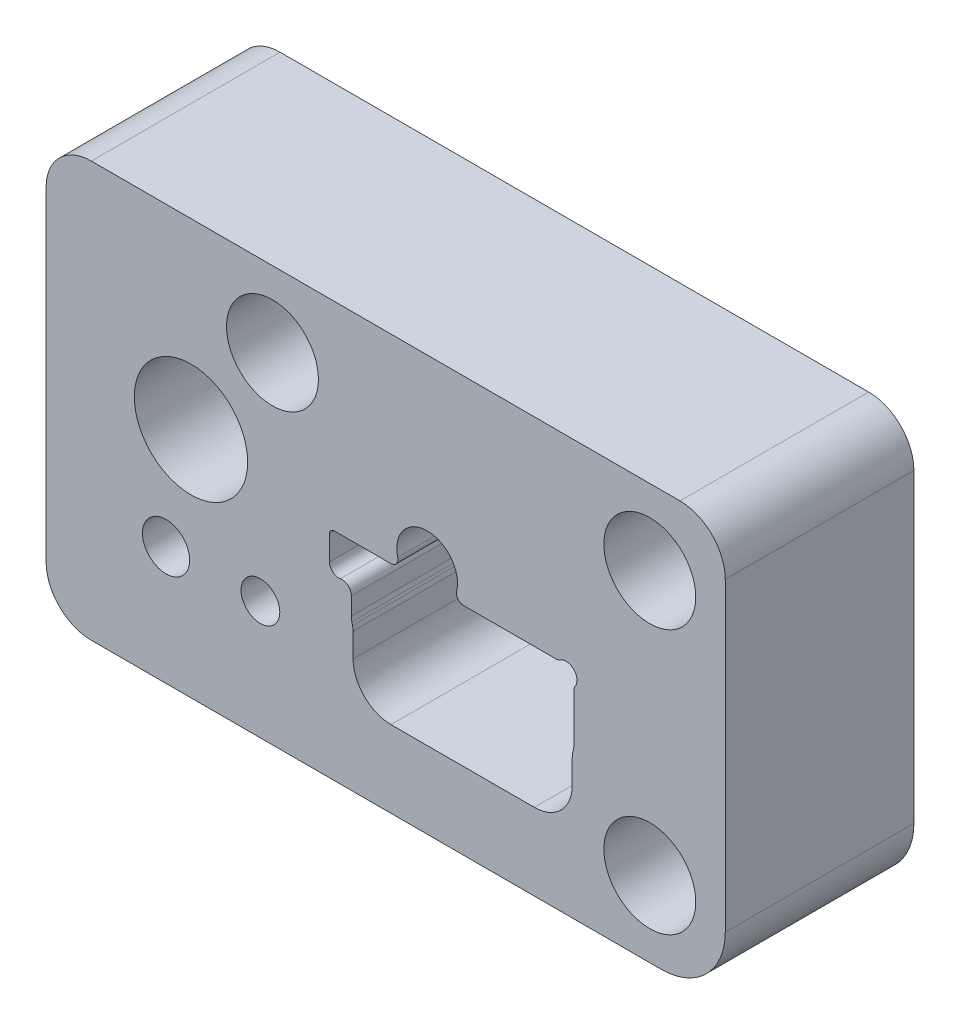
SolidWorks part; units mm, degrees
ref_plane "Front" through (0, 0, 0) normal (0, 0, 1) x (1, 0, 0)
ref_plane "Top" through (0, 0, 0) normal (0, 1, 0) x (1, 0, 0)
ref_plane "Right" through (0, 0, 0) normal (1, 0, 0) x (0, 0, -1)
ref_plane "Plane1"
sketch "Sketch1" plane through (0, 0, 0) normal (0, 0, 1) x (1, 0, 0)
  line L1 (-200.025, -47.625) -> (-100.965, -47.625)
  line L2 (-207.645, -55.245) -> (-207.645, -109.855)
  line L3 (-200.025, -117.475) -> (-104.14, -117.475)
  line L4 (-93.345, -55.245) -> (-93.345, -106.68)
  line L5 (-57.15, -180.975) -> (-450.85, -180.975) construction
  line L10 (-141.351, 0) -> (-181.102, 0) construction
  line L11 (-141.351, -85.471) -> (-141.351, 85.471) construction
  arc A2 (-100.965, -47.625) -> (-93.345, -55.245) centre (-100.965, -55.245) cw
  arc A3 (-207.645, -109.855) -> (-200.025, -117.475) centre (-200.025, -109.855) ccw
  arc A4 (-104.14, -117.475) -> (-93.345, -106.68) centre (-104.14, -106.68) ccw
  arc A5 (-200.025, -47.625) -> (-207.645, -55.245) centre (-200.025, -55.245) ccw
  point P19 (-93.345, -47.625)
  point P24 (-93.345, -117.475)
  point P27 (-207.645, -47.625)
extrude "Boss-Extrude1" add sketch "Sketch1" against normal blind 31.75 flip side to cut
hole_wizard "Hole1" positions "Point_Sketch" profile "Profil_Sketch" counterbore size "1/4" standard "ANSI Inch"
sketch "Point_Sketch" plane through (-74.4641, -53.04, 0) normal (0, 0, -1) x (1, 0, 0)
  point P0 (-31.5809, 7.285)
  point P2 (-31.5809, 51.735)
  point P4 (-95.0809, 7.285)
sketch "Profil_Sketch" plane through (-106.045, -60.325, 0) normal (1, 0, 0) x (0, -1, 0)
  line L0 (0, 0) -> (0, 31.75)
  line L1 (0, 31.75) -> (5.1562, 31.75)
  line L3 (5.1562, 31.75) -> (5.1562, 17.526)
  line L4 (5.1562, 17.526) -> (7.7343, 17.526)
  line L5 (7.7343, 17.526) -> (7.7343, 0)
  line L7 (7.7343, 0) -> (0, 0)
  line L11 (0, -6.35) -> (0, 107.95) construction
  dimension "Diameter" = 10.3124
  dimension "Thru Hole Depth" = 31.75
  dimension "L1" = 17.526
other "usin_LS160_.375-16x1.75-SHCS<1>"
ref_plane "Plane2 QU250515L_Punch[Mounted in the strip]-3"
ref_plane "Plane1 QU250515L_Punch[Mounted in the strip]-3"
sketch "Sketch2 QU250515L_Punch[Mounted in the strip]-3" plane through (0, 0, 0) normal (0, 0, 1) x (1, 0, 0)
  line L0 (-119.126, -98.171) -> (-119.126, -84.1078)
  line L1 (-149.606, -104.521) -> (-125.476, -104.521)
  line L2 (-155.956, -88.8003) -> (-155.956, -98.171)
  line L3 (-159.5202, -82.2415) -> (-157.4416, -84.7186)
  line L4 (-149.6352, -81.407) -> (-159.131, -81.407)
  line L5 (-121.8268, -81.407) -> (-137.3848, -81.407)
  line L6 (-121.8268, -81.407) -> (-137.3848, -81.407)
  line L7 (-149.6352, -81.407) -> (-159.131, -81.407)
  line L8 (-159.5202, -82.2415) -> (-157.4416, -84.7186)
  line L9 (-155.956, -88.8003) -> (-155.956, -98.171)
  line L10 (-149.606, -104.521) -> (-125.476, -104.521)
  line L11 (-119.126, -98.171) -> (-119.126, -84.1078)
  arc A0 (-118.872, -83.2654) -> (-120.9844, -81.153) centre (-120.142, -82.423) ccw
  arc A1 (-118.872, -83.2654) -> (-119.126, -84.1078) centre (-117.602, -84.1078) ccw
  arc A2 (-125.476, -104.521) -> (-119.126, -98.171) centre (-125.476, -98.171) ccw
  arc A3 (-155.956, -98.171) -> (-149.606, -104.521) centre (-149.606, -98.171) ccw
  arc A4 (-155.956, -88.8003) -> (-157.4416, -84.7186) centre (-162.306, -88.8003) ccw
  arc A5 (-159.131, -81.407) -> (-159.5202, -82.2415) centre (-159.131, -81.915) ccw
  arc A6 (-149.6352, -81.407) -> (-148.1562, -79.515) centre (-149.6352, -79.883) ccw
  arc A7 (-138.8638, -79.515) -> (-148.1562, -79.515) centre (-143.51, -78.359) ccw
  arc A8 (-138.8638, -79.515) -> (-137.3848, -81.407) centre (-137.3848, -79.883) ccw
  arc A9 (-121.8268, -81.407) -> (-120.9844, -81.153) centre (-121.8268, -79.883) ccw
  arc A10 (-121.8268, -81.407) -> (-120.9844, -81.153) centre (-121.8268, -79.883) ccw
  arc A11 (-138.8638, -79.515) -> (-137.3848, -81.407) centre (-137.3848, -79.883) ccw
  arc A12 (-138.8638, -79.515) -> (-148.1562, -79.515) centre (-143.51, -78.359) ccw
  arc A13 (-149.6352, -81.407) -> (-148.1562, -79.515) centre (-149.6352, -79.883) ccw
  arc A14 (-159.131, -81.407) -> (-159.5202, -82.2415) centre (-159.131, -81.915) ccw
  arc A15 (-155.956, -88.8003) -> (-157.4416, -84.7186) centre (-162.306, -88.8003) ccw
  arc A16 (-155.956, -98.171) -> (-149.606, -104.521) centre (-149.606, -98.171) ccw
  arc A17 (-125.476, -104.521) -> (-119.126, -98.171) centre (-125.476, -98.171) ccw
  arc A18 (-118.872, -83.2654) -> (-119.126, -84.1078) centre (-117.602, -84.1078) ccw
  arc A19 (-118.872, -83.2654) -> (-120.9844, -81.153) centre (-120.142, -82.423) ccw
  circle A20 centre (-146.431, -93.091) radius 6.5405
  circle A21 centre (-128.651, -93.091) radius 6.5405
  circle A26 centre (-143.51, -78.359) radius 1.2065
  circle A32 centre (-128.651, -93.091) radius 6.5405
  circle A33 centre (-146.431, -93.091) radius 6.5405
  circle A37 centre (-143.51, -78.359) radius 1.2065
sketch "Sketch1 QU250515L_Punch[Mounted in the strip]-3" plane through (0, 0, -4.7625) normal (0, 0, 1) x (1, 0, 0)
  line L0 (-159.5202, -82.2415) -> (-157.4416, -84.7186) construction
  line L1 (-149.6352, -81.407) -> (-159.131, -81.407) construction
  line L2 (-121.8268, -81.407) -> (-137.3848, -81.407) construction
  line L3 (-159.5202, -82.2415) -> (-157.4416, -84.7186) construction
  line L4 (-149.6352, -81.407) -> (-159.131, -81.407) construction
  line L5 (-121.8268, -81.407) -> (-137.3848, -81.407) construction
  line L18 (-119.126, -92.4223) -> (-119.126, -84.1078) construction
  line L19 (-119.126, -98.171) -> (-119.126, -84.1078) construction
  line L20 (-155.956, -88.8003) -> (-155.956, -92.4295) construction
  line L21 (-155.956, -88.8003) -> (-155.956, -98.171) construction
  line L22 (-155.9814, -92.4311) -> (-155.9814, -98.171) construction
  line L23 (-159.7653, -82.4473) -> (-157.6868, -84.9244)
  line L24 (-149.6352, -81.087) -> (-159.131, -81.087)
  line L25 (-121.8268, -81.087) -> (-137.3848, -81.087)
  line L26 (-119.1006, -98.171) -> (-119.1006, -92.5853) construction
  line L27 (-155.956, -92.4311) -> (-155.956, -98.171) construction
  line L28 (-119.126, -98.171) -> (-119.126, -92.5853) construction
  line L29 (-149.606, -104.521) -> (-125.476, -104.521) construction
  line L30 (-149.606, -104.521) -> (-125.476, -104.521) construction
  line L31 (-155.9814, -94.1476) -> (-155.9814, -98.171)
  line L32 (-149.606, -104.5464) -> (-125.476, -104.5464)
  line L33 (-119.1006, -98.171) -> (-119.1006, -94.1476)
  line L34 (-156.276, -88.8003) -> (-156.276, -92.4295) construction
  line L35 (-118.806, -92.4223) -> (-118.806, -84.1078) construction
  line L36 (-156.276, -88.8003) -> (-156.276, -92.0344)
  line L37 (-118.806, -92.0344) -> (-118.806, -84.1078)
  line L38 (-156.1808, -92.8667) -> (-156.0767, -93.3153)
  line L39 (-119.0053, -93.3153) -> (-118.9012, -92.8667)
  arc A0 (-155.956, -88.8003) -> (-157.4416, -84.7186) centre (-162.306, -88.8003) ccw construction
  arc A1 (-159.131, -81.407) -> (-159.5202, -82.2415) centre (-159.131, -81.915) ccw construction
  arc A2 (-149.6352, -81.407) -> (-148.1562, -79.515) centre (-149.6352, -79.883) ccw construction
  arc A3 (-138.8638, -79.515) -> (-148.1562, -79.515) centre (-143.51, -78.359) ccw construction
  arc A4 (-138.8638, -79.515) -> (-137.3848, -81.407) centre (-137.3848, -79.883) ccw construction
  arc A5 (-121.8268, -81.407) -> (-120.9844, -81.153) centre (-121.8268, -79.883) ccw construction
  arc A6 (-118.872, -83.2654) -> (-120.9844, -81.153) centre (-120.142, -82.423) ccw construction
  arc A7 (-118.872, -83.2654) -> (-119.126, -84.1078) centre (-117.602, -84.1078) ccw construction
  arc A8 (-155.956, -88.8003) -> (-157.4416, -84.7186) centre (-162.306, -88.8003) ccw construction
  arc A9 (-159.131, -81.407) -> (-159.5202, -82.2415) centre (-159.131, -81.915) ccw construction
  arc A11 (-149.6352, -81.407) -> (-148.1562, -79.515) centre (-149.6352, -79.883) ccw construction
  arc A12 (-138.8638, -79.515) -> (-148.1562, -79.515) centre (-143.51, -78.359) ccw construction
  arc A13 (-138.8638, -79.515) -> (-137.3848, -81.407) centre (-137.3848, -79.883) ccw construction
  arc A14 (-121.8268, -81.407) -> (-120.9844, -81.153) centre (-121.8268, -79.883) ccw construction
  arc A15 (-118.872, -83.2654) -> (-120.9844, -81.153) centre (-120.142, -82.423) ccw construction
  arc A18 (-118.872, -83.2654) -> (-119.126, -84.1078) centre (-117.602, -84.1078) ccw construction
  arc A19 (-156.276, -88.8003) -> (-157.6868, -84.9244) centre (-162.306, -88.8003) ccw
  arc A20 (-159.131, -81.087) -> (-159.7653, -82.4473) centre (-159.131, -81.915) ccw
  arc A21 (-149.6352, -81.087) -> (-148.4668, -79.5923) centre (-149.6352, -79.883) ccw
  arc A22 (-138.5532, -79.5923) -> (-148.4668, -79.5923) centre (-143.51, -78.359) ccw
  arc A23 (-138.5532, -79.5923) -> (-137.3848, -81.087) centre (-137.3848, -79.883) ccw
  arc A24 (-121.8268, -81.087) -> (-121.1613, -80.8863) centre (-121.8268, -79.883) ccw
  arc A25 (-118.6053, -83.4423) -> (-121.1613, -80.8863) centre (-120.142, -82.423) ccw
  arc A26 (-118.6053, -83.4423) -> (-118.806, -84.1078) centre (-117.602, -84.1078) ccw
  arc A27 (-125.476, -104.521) -> (-119.126, -98.171) centre (-125.476, -98.171) ccw construction
  arc A28 (-155.956, -98.171) -> (-149.606, -104.521) centre (-149.606, -98.171) ccw construction
  arc A29 (-125.476, -104.521) -> (-119.126, -98.171) centre (-125.476, -98.171) ccw construction
  arc A30 (-155.956, -98.171) -> (-149.606, -104.521) centre (-149.606, -98.171) ccw construction
  arc A31 (-155.9814, -98.171) -> (-149.606, -104.5464) centre (-149.606, -98.171) ccw
  arc A32 (-125.476, -104.5464) -> (-119.1006, -98.171) centre (-125.476, -98.171) ccw
  arc A33 (-155.9814, -94.1476) -> (-156.0767, -93.3153) centre (-159.6644, -94.1476) ccw
  arc A34 (-119.1006, -94.1476) -> (-119.0053, -93.3153) centre (-115.4176, -94.1476) cw
  arc A35 (-118.806, -92.0344) -> (-118.9012, -92.8667) centre (-122.489, -92.0344) cw
  arc A36 (-156.276, -92.0344) -> (-156.1808, -92.8667) centre (-152.593, -92.0344) ccw
  point P69 (-155.9814, -93.726)
  point P77 (-156.276, -92.456)
sketch "Sketch6" plane through (0, 0, 0) normal (0, 0, 1) x (1, 0, 0)
  circle A0 centre (-183.261, -78.359) radius 9.5377
  circle A1 centre (-302.514, -78.359) radius 9.5377 construction
extrude "Cut-Extrude2" cut sketch "Sketch6" against normal through all
hole_wizard "Hole12" positions "Point_Sketch2" profile "Profil_Sketch2" tap size "5/16-18" standard "ANSI Inch"
sketch "Point_Sketch2" plane through (-173.9939, -87.9303, 0) normal (0, 0, -1) x (-1, 0, 0)
  point P0 (-2.4169, -9.6057)
sketch "Profil_Sketch2" plane through (-171.577, -97.536, 0) normal (1, 0, 0) x (0, -1, 0)
  line L0 (0, 0) -> (0, 31.75)
  line L1 (0, 31.75) -> (3.2639, 31.75)
  line L2 (3.2639, 31.75) -> (3.2639, 0)
  line L5 (3.2639, 0) -> (0, 0)
  line L11 (0, -6.35) -> (0, 107.95) construction
  dimension "Thru Tap Drill Dia." = 6.5278
  dimension "Thru Tap Drill Depth" = 31.75
other "usin_TS230_.3125-18x.75-SHCS<1>"
hole_wizard "Hole13" positions "Point_Sketch3" profile "Profil_Sketch3" hole size "Ø0.15" standard "ISO"
sketch "Point_Sketch3" plane through (-183.7977, -86.9349, -31.75) normal (0, 0, 1) x (-1, 0, 0)
  point P0 (3.6543, 10.6011)
sketch "Profil_Sketch3" plane through (-187.452, -97.536, -31.75) normal (1, 0, 0) x (0, 1, 0)
  line L0 (0, 0) -> (0, 31.75)
  line L1 (0, 31.75) -> (3.9687, 31.75)
  line L2 (3.9687, 31.75) -> (3.9687, 0)
  line L5 (3.9687, 0) -> (0, 0)
  line L11 (0, -6.35) -> (0, 107.95) construction
  dimension "Diameter" = 7.9375
  dimension "Thru Hole Depth" = 31.75
other "usin_DL090_.3125 x 1.25 DOWEL PIN<1>"
extrude "Cut-Extrude1 QU250515L_Punch[Mounted in the strip]-3" cut sketch "Sketch1 QU250515L_Punch[Mounted in the strip]-3" against normal through all and the other way through all
sketch "Sketch7" plane through (0, 0, 0) normal (0, 0, 1) x (1, 0, 0)
  line L0 (-159.959, -81.915) -> (-159.959, -85.979)
  line L3 (-141.351, -85.471) -> (-181.102, -85.471) construction
  line L4 (-158.877, -84.1078) -> (-158.877, -85.471) construction
  line L10 (-155.9814, -94.1476) -> (-155.9814, -98.171)
  line L11 (-149.606, -104.5464) -> (-125.476, -104.5464)
  line L12 (-119.1006, -98.171) -> (-119.1006, -94.1476)
  line L13 (-119.0053, -93.3153) -> (-118.9012, -92.8667)
  line L14 (-118.806, -92.0344) -> (-118.806, -84.1078)
  line L15 (-121.8268, -81.087) -> (-137.3848, -81.087)
  line L16 (-149.6352, -81.087) -> (-159.131, -81.087)
  line L17 (-159.7653, -82.4473) -> (-157.6868, -84.9244)
  line L18 (-156.276, -88.8003) -> (-156.276, -92.0344)
  line L19 (-156.1808, -92.8667) -> (-156.0767, -93.3153)
  line L27 (-159.7653, -82.4473) -> (-157.6868, -84.9244)
  line L28 (-156.276, -88.8003) -> (-156.276, -89.1131)
  arc A0 (-159.959, -85.979) -> (-158.1175, -87.546) centre (-158.3715, -85.979) ccw
  arc A1 (-156.276, -89.1131) -> (-158.1175, -87.546) centre (-157.8635, -89.1131) ccw
  arc A14 (-155.9814, -98.171) -> (-149.606, -104.5464) centre (-149.606, -98.171) ccw
  arc A15 (-125.476, -104.5464) -> (-119.1006, -98.171) centre (-125.476, -98.171) ccw
  arc A16 (-119.0053, -93.3153) -> (-119.1006, -94.1476) centre (-115.4176, -94.1476) ccw
  arc A17 (-118.9012, -92.8667) -> (-118.806, -92.0344) centre (-122.489, -92.0344) ccw
  arc A18 (-118.6053, -83.4423) -> (-118.806, -84.1078) centre (-117.602, -84.1078) ccw
  arc A19 (-118.6053, -83.4423) -> (-121.1613, -80.8863) centre (-120.142, -82.423) ccw
  arc A20 (-121.8268, -81.087) -> (-121.1613, -80.8863) centre (-121.8268, -79.883) ccw
  arc A21 (-138.5532, -79.5923) -> (-137.3848, -81.087) centre (-137.3848, -79.883) ccw
  arc A22 (-138.5532, -79.5923) -> (-148.4668, -79.5923) centre (-143.51, -78.359) ccw
  arc A23 (-149.6352, -81.087) -> (-148.4668, -79.5923) centre (-149.6352, -79.883) ccw
  arc A24 (-159.131, -81.087) -> (-159.7653, -82.4473) centre (-159.131, -81.915) ccw
  arc A25 (-156.276, -88.8003) -> (-157.6868, -84.9244) centre (-162.306, -88.8003) ccw
  arc A26 (-156.276, -92.0344) -> (-156.1808, -92.8667) centre (-152.593, -92.0344) ccw
  arc A27 (-155.9814, -94.1476) -> (-156.0767, -93.3153) centre (-159.6644, -94.1476) ccw
  arc A38 (-159.959, -81.915) -> (-159.7653, -82.4473) centre (-159.131, -81.915) ccw
  arc A39 (-156.276, -88.8003) -> (-157.6868, -84.9244) centre (-162.306, -88.8003) ccw
  dimension "D2" = 1.5875
  dimension "D3" = 0.508
  dimension "D4" = 1.082
  dimension "D1" = 0
extrude "Cut-Extrude3" cut sketch "Sketch7" against normal through all
